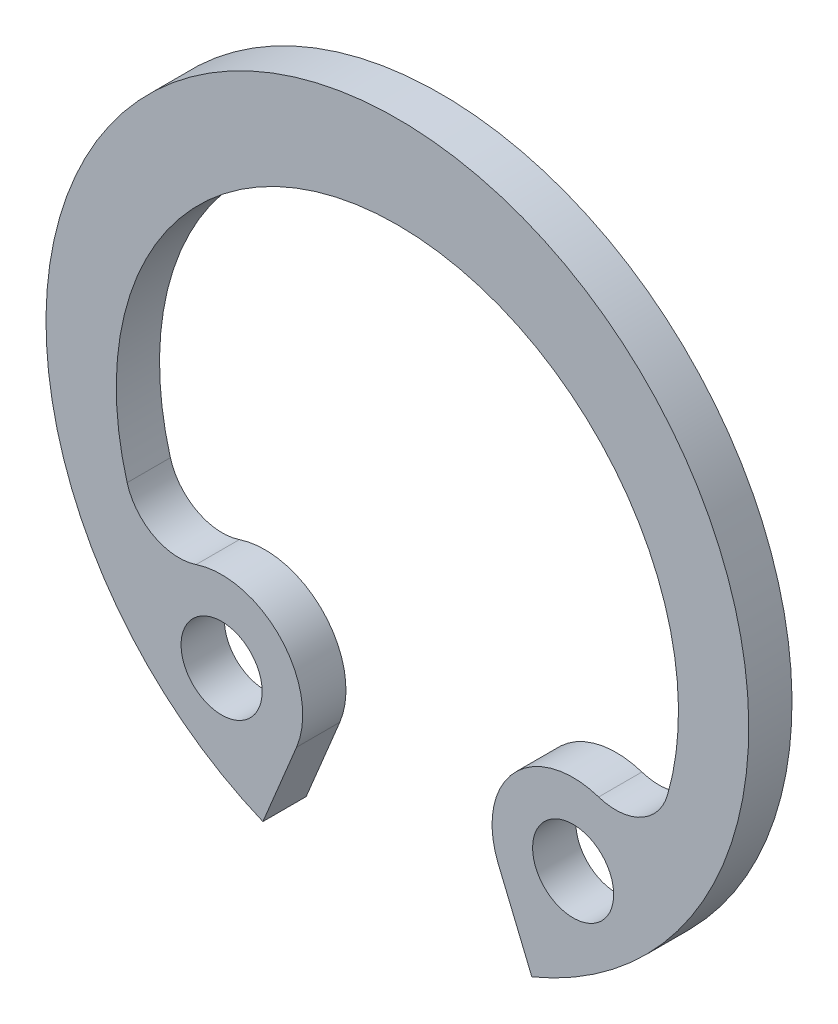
SolidWorks part; units mm, degrees
ref_plane "Front" through (0, 0, 0) normal (0, 0, 1) x (1, 0, 0)
ref_plane "Top" through (0, 0, 0) normal (0, 1, 0) x (1, 0, 0)
ref_plane "Right" through (0, 0, 0) normal (1, 0, 0) x (0, 0, -1)
other "Configuration Table"
sketch "Sketch1" plane through (0, 0, 0) normal (0, 0, 1) x (1, 0, 0)
  line L0 (0, 0) -> (-1.8654, -4.5034) construction
  line L1 (0, 7.3554) -> (0, -7.1505) construction
  line L2 (1.8654, -4.5034) -> (2.4874, -6.0052)
  line L4 (-1.8654, -4.5034) -> (-2.4874, -6.0052)
  arc A0 (2.4874, -6.0052) -> (-2.4874, -6.0052) centre (0, 0) ccw
  arc A1 (4.999, -1.8316) -> (-4.999, -1.8316) centre (0, -0.4) ccw
  arc A2 (-1.8654, -4.5034) -> (-3.7231, -2.5055) centre (-3.2512, -3.9294) ccw
  arc A3 (-4.999, -1.8316) -> (-3.7231, -2.5055) centre (-4.0377, -1.5563) ccw
  circle A4 centre (3.2512, -3.9294) radius 0.75
  arc A5 (4.999, -1.8316) -> (3.7231, -2.5055) centre (4.0377, -1.5563) cw
  arc A6 (-5.1, 0) -> (5.1, 0) centre (0, 0) ccw construction
  circle A7 centre (-3.2512, -3.9294) radius 0.75
  arc A8 (1.8654, -4.5034) -> (3.7231, -2.5055) centre (3.2512, -3.9294) cw
  dimension "D" = 13
  dimension "d0" = 10.4
  dimension "R1" = 1.5
  dimension "R2" = 1
  dimension "d1" = 1.5
  dimension "R" = 5.1
  dimension "C" = 0.4
  dimension "Angle" = 45
extrude "Body" add sketch "Sketch1" against normal blind 0.8
